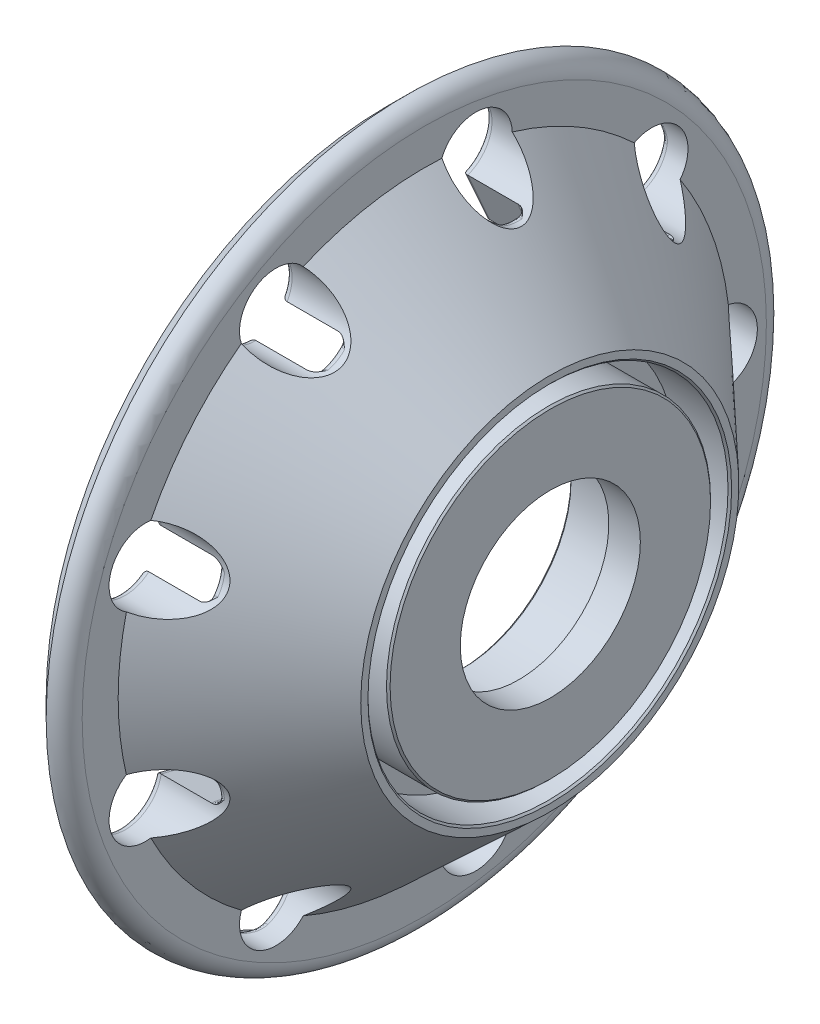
SolidWorks part; units mm, degrees
ref_plane "Plan de face" through (0, 0, 0) normal (0, 0, 1) x (1, 0, 0)
ref_plane "Plan de dessus" through (0, 0, 0) normal (0, 1, 0) x (1, 0, 0)
ref_plane "Plan de droite" through (0, 0, 0) normal (1, 0, 0) x (0, 0, -1)
ref_plane "Plan1" through (0, 0, 0) normal (0, 0, -1) x (-1, 0, 0)
sketch "Esquisse1" plane through (0, 0, 0) normal (0, 0, -1) x (-1, 0, 0)
  line L0 (0.0592, 21) -> (0.0592, 0)
  line L1 (0.0592, 0) -> (18, 0)
  line L2 (18, 0) -> (18, 38)
  line L3 (18, 38) -> (16, 40)
  line L4 (14, 38) -> (14, 34)
  line L5 (14, 34) -> (0.0592, 21)
  line L6 (0.0592, 0) -> (18, 0) construction
  arc A0 (16, 40) -> (14, 38) centre (16, 38) ccw
revolve "Révolution1" add sketch "Esquisse1" angle 360 about L6
sketch "Esquisse2" plane through (-18, 0, 0) normal (-1, 0, 0) x (0, 0, 1)
  line L0 (12.984, 26.489) -> (7.5426, 23.835)
  line L1 (7.5426, 23.835) -> (1.0643, 24.9773)
  line L2 (1.0643, 24.9773) -> (-3.1412, 29.3323)
  line L3 (-7.0805, 28.6377) -> (-9.5429, 23.107)
  line L4 (-9.5429, 23.107) -> (-15.2398, 19.8179)
  line L5 (-15.2398, 19.8179) -> (-21.2607, 20.4507)
  line L6 (-23.8319, 17.3865) -> (-22.1632, 11.567)
  line L7 (-22.1632, 11.567) -> (-24.4131, 5.3854)
  line L8 (-24.4131, 5.3854) -> (-29.4321, 2)
  line L9 (-29.4321, -2) -> (-24.4131, -5.3854)
  line L10 (-24.4131, -5.3854) -> (-22.1632, -11.567)
  line L11 (-22.1632, -11.567) -> (-23.8319, -17.3865)
  line L12 (-21.2607, -20.4507) -> (-15.2398, -19.8179)
  line L13 (-15.2398, -19.8179) -> (-9.5429, -23.107)
  line L14 (-9.5429, -23.107) -> (-7.0805, -28.6377)
  line L15 (-3.1412, -29.3323) -> (1.0643, -24.9773)
  line L16 (1.0643, -24.9773) -> (7.5426, -23.835)
  line L17 (7.5426, -23.835) -> (12.984, -26.489)
  line L18 (16.4481, -24.489) -> (16.8704, -18.4496)
  line L19 (16.8704, -18.4496) -> (21.0989, -13.4104)
  line L20 (21.0989, -13.4104) -> (26.9731, -11.9458)
  line L21 (28.3412, -8.187) -> (24.7827, -3.2891)
  line L22 (24.7827, -3.2891) -> (24.7827, 3.2891)
  line L23 (24.7827, 3.2891) -> (28.3412, 8.187)
  line L24 (26.9731, 11.9458) -> (21.0989, 13.4104)
  line L25 (21.0989, 13.4104) -> (16.8704, 18.4496)
  line L26 (16.8704, 18.4496) -> (16.4481, 24.489)
  arc A0 (-3.1412, 29.3323) -> (-7.0805, 28.6377) centre (-5.722, 32.4512) cw
  arc A1 (-21.2607, 20.4507) -> (-23.8319, 17.3865) centre (-25.2425, 21.181) cw
  arc A2 (-29.4321, 2) -> (-29.4321, -2) centre (-32.9518, 0) cw
  arc A3 (-23.8319, -17.3865) -> (-21.2607, -20.4507) centre (-25.2425, -21.181) cw
  arc A4 (-7.0805, -28.6377) -> (-3.1412, -29.3323) centre (-5.722, -32.4512) cw
  arc A5 (12.984, -26.489) -> (16.4481, -24.489) centre (16.4759, -28.5371) cw
  arc A6 (26.9731, -11.9458) -> (28.3412, -8.187) centre (30.9646, -11.2702) cw
  arc A7 (28.3412, 8.187) -> (26.9731, 11.9458) centre (30.9646, 11.2702) cw
  arc A8 (16.4481, 24.489) -> (12.984, 26.489) centre (16.4759, 28.5371) cw
extrude "Extrusion1" cut sketch "Esquisse2" against normal blind 8
draft "Dépouille1" [suppressed] type of draft neutral plane draft angle 2 faces to draft 9 parameters "D1"=2
ref_plane "Plan2" through (0, 28.5371, 0) normal (0, 1, 0) x (-1, 0, 0)
sketch "Esquisse3" plane through (0, 28.5371, 0) normal (0, 1, 0) x (-1, 0, 0)
  line L0 (8.5348, 16.4759) -> (8.5348, 12.4277)
  line L1 (8.5348, 12.4277) -> (14, 12.4277)
  line L2 (14, 12.4277) -> (14, 16.4759)
  line L3 (14, 16.4759) -> (8.5348, 16.4759)
  line L4 (14, 16.4759) -> (8.5348, 16.4759) construction
revolve "Révolution2" add sketch "Esquisse3" angle 360 about L3
ref_plane "Plan3" through (0, 0, 0) normal (0, 0.9397, 0.342) x (-1, 0, 0)
sketch "Esquisse4" plane through (0, 0, 0) normal (0, 0.9397, 0.342) x (-1, 0, 0)
  line L0 (8.5348, 37) -> (8.5348, 32.9518)
  line L1 (8.5348, 32.9518) -> (14, 32.9518)
  line L2 (14, 32.9518) -> (14, 37)
  line L3 (14, 37) -> (8.5348, 37)
  line L4 (8.5348, 32.9518) -> (14, 32.9518) construction
revolve "Révolution3" add sketch "Esquisse4" angle 360 about L1
ref_plane "Plan4" through (0, 0, 0) normal (0, 0.5, 0.866) x (1, 0, 0)
sketch "Esquisse5" plane through (0, 0, 0) normal (0, 0.5, 0.866) x (1, 0, 0)
  line L0 (-8.5348, -37) -> (-8.5348, -32.9518)
  line L1 (-8.5348, -32.9518) -> (-14, -32.9518)
  line L2 (-14, -32.9518) -> (-14, -37)
  line L3 (-14, -37) -> (-8.5348, -37)
  line L4 (-8.5348, -32.9518) -> (-14, -32.9518) construction
revolve "Révolution4" add sketch "Esquisse5" angle 360 about L4
ref_plane "Plan5" through (0, 0, 0) normal (0, -0.1736, 0.9848) x (1, 0, 0)
sketch "Esquisse6" plane through (0, 0, 0) normal (0, -0.1736, 0.9848) x (1, 0, 0)
  line L0 (-8.5348, -37) -> (-8.5348, -32.9518)
  line L1 (-8.5348, -32.9518) -> (-14, -32.9518)
  line L2 (-14, -32.9518) -> (-14, -37)
  line L3 (-14, -37) -> (-8.5348, -37)
  line L4 (-8.5348, -32.9518) -> (-14, -32.9518) construction
revolve "Révolution5" add sketch "Esquisse6" angle 360 about L1
ref_plane "Plan6" through (0, 0, 0) normal (0, 0.766, -0.6428) x (-1, 0, 0)
sketch "Esquisse7" plane through (0, 0, 0) normal (0, 0.766, -0.6428) x (-1, 0, 0)
  line L0 (8.5348, -28.9036) -> (8.5348, -32.9518)
  line L1 (8.5348, -32.9518) -> (14, -32.9518)
  line L2 (14, -32.9518) -> (14, -28.9036)
  line L3 (14, -28.9036) -> (8.5348, -28.9036)
  line L4 (8.5348, -32.9518) -> (14, -32.9518) construction
revolve "Révolution6" add sketch "Esquisse7" angle 360 about L1
sketch "Esquisse8" plane through (0, 0, 0) normal (0, 1, 0) x (1, 0, 0)
  line L0 (-8.5348, 32.9518) -> (-8.5348, 37)
  line L1 (-8.5348, 37) -> (-14, 37)
  line L2 (-14, 37) -> (-14, 32.9518)
  line L3 (-14, 32.9518) -> (-8.5348, 32.9518)
  line L4 (-14, 32.9518) -> (-8.5348, 32.9518) construction
revolve "Révolution7" add sketch "Esquisse8" angle 360 about L3
ref_plane "Plan7" through (0, 0, 0) normal (0, 0.766, 0.6428) x (-1, 0, 0)
sketch "Esquisse9" plane through (0, 0, 0) normal (0, 0.766, 0.6428) x (-1, 0, 0)
  line L0 (8.5348, -32.9518) -> (8.5348, -37)
  line L1 (8.5348, -37) -> (14, -37)
  line L2 (14, -37) -> (14, -32.9518)
  line L3 (14, -32.9518) -> (8.5348, -32.9518)
  line L4 (14, -32.9518) -> (8.5348, -32.9518) construction
revolve "Révolution8" add sketch "Esquisse9" angle 360 about L3
ref_plane "Plan8" through (0, 0, 0) normal (0, 0.1736, 0.9848) x (1, 0, 0)
sketch "Esquisse10" plane through (0, 0, 0) normal (0, 0.1736, 0.9848) x (1, 0, 0)
  line L0 (-8.5348, 28.9036) -> (-8.5348, 32.9518)
  line L1 (-8.5348, 32.9518) -> (-14, 32.9518)
  line L2 (-14, 32.9518) -> (-14, 28.9036)
  line L3 (-14, 28.9036) -> (-8.5348, 28.9036)
  line L4 (-8.5348, 32.9518) -> (-14, 32.9518) construction
revolve "Révolution9" add sketch "Esquisse10" angle 360 about L4
ref_plane "Plan9" through (0, 0, 0) normal (0, 0.9397, -0.342) x (-1, 0, 0)
sketch "Esquisse11" plane through (0, 0, 0) normal (0, 0.9397, -0.342) x (-1, 0, 0)
  line L0 (8.5348, 37) -> (8.5348, 32.9518)
  line L1 (8.5348, 32.9518) -> (14, 32.9518)
  line L2 (14, 32.9518) -> (14, 37)
  line L3 (14, 37) -> (8.5348, 37)
  line L4 (8.5348, 32.9518) -> (14, 32.9518) construction
revolve "Révolution10" add sketch "Esquisse11" angle 360 about L1
hole_wizard "Perçage1" positions "Esquisse13" profile "Esquisse12" legacy
sketch "Esquisse13" plane through (-0.0592, 0, 0) normal (1, 0, 0) x (0, 0, -1)
  point P0 (0, 0)
sketch "Esquisse12" plane through (-0.0592, 0, 0) normal (0, 1, 0) x (0, 0, -1)
  line L0 (0, 0) -> (0, 5.9408)
  line L1 (0, 5.9408) -> (20, 5.9408)
  line L2 (20, 5.9408) -> (20, 0)
  line L3 (20, 0) -> (0, 0)
  line L4 (0, 110) -> (0, -10) construction
  dimension "Diamètre" = 40
  dimension "Profondeur" = 5.9408
sketch "Esquisse14" plane through (0, 0, 0) normal (0, 1, 0) x (1, 0, 0)
  line L0 (-18, 37) -> (-18, 0)
  line L1 (-18, 0) -> (-17, 0)
  line L2 (-17, 0) -> (-17, 37)
  line L3 (-17, 37) -> (-18, 37)
  line L4 (-18, 0) -> (-17, 0) construction
revolve "Enlèvement de matière-Révolution1" cut sketch "Esquisse14" angle 360 about L1
ref_plane "Plan10" through (0, 0, 16.4759) normal (0, 0, 1) x (1, 0, 0)
sketch "Esquisse15" plane through (0, 0, 16.4759) normal (0, 0, 1) x (1, 0, 0)
  line L0 (-17, 32.5853) -> (-17, 28.5371)
  line L1 (-17, 28.5371) -> (-8.5348, 28.5371)
  line L2 (-8.5348, 28.5371) -> (-8.5348, 32.5853)
  line L3 (-8.5348, 32.5853) -> (-17, 32.5853)
  line L4 (-17, 28.5371) -> (-8.5348, 28.5371) construction
revolve "Enlèvement de matière-Révolution2" cut sketch "Esquisse15" angle 360 about L1
ref_plane "Plan11" through (0, 0, 30.9646) normal (0, 0, 1) x (1, 0, 0)
sketch "Esquisse16" plane through (0, 0, 30.9646) normal (0, 0, 1) x (1, 0, 0)
  line L0 (-17, 15.3184) -> (-17, 11.2702)
  line L1 (-17, 11.2702) -> (-8.5348, 11.2702)
  line L2 (-8.5348, 11.2702) -> (-8.5348, 15.3184)
  line L3 (-8.5348, 15.3184) -> (-17, 15.3184)
  line L4 (-17, 11.2702) -> (-8.5348, 11.2702) construction
revolve "Enlèvement de matière-Révolution3" cut sketch "Esquisse16" angle 360 about L1
ref_plane "Plan12" through (0, 0, 30.9646) normal (0, 0, 1) x (1, 0, 0)
sketch "Esquisse17" plane through (0, 0, 30.9646) normal (0, 0, 1) x (1, 0, 0)
  line L0 (-17, -7.222) -> (-17, -11.2702)
  line L1 (-17, -11.2702) -> (-8.5348, -11.2702)
  line L2 (-8.5348, -11.2702) -> (-8.5348, -7.222)
  line L3 (-8.5348, -7.222) -> (-17, -7.222)
  line L4 (-17, -11.2702) -> (-8.5348, -11.2702) construction
revolve "Enlèvement de matière-Révolution4" cut sketch "Esquisse17" angle 360 about L1
ref_plane "Plan13" through (0, 0, 16.4759) normal (0, 0, 1) x (1, 0, 0)
sketch "Esquisse18" plane through (0, 0, 16.4759) normal (0, 0, 1) x (1, 0, 0)
  line L0 (-17, -24.4889) -> (-17, -28.5371)
  line L1 (-17, -28.5371) -> (-8.5348, -28.5371)
  line L2 (-8.5348, -28.5371) -> (-8.5348, -24.4889)
  line L3 (-8.5348, -24.4889) -> (-17, -24.4889)
  line L4 (-17, -28.5371) -> (-8.5348, -28.5371) construction
revolve "Enlèvement de matière-Révolution5" cut sketch "Esquisse18" angle 360 about L1
ref_plane "Plan14" through (0, 0, -5.722) normal (0, 0, 1) x (1, 0, 0)
sketch "Esquisse19" plane through (0, 0, -5.722) normal (0, 0, 1) x (1, 0, 0)
  line L0 (-17, -28.403) -> (-17, -32.4512)
  line L1 (-17, -32.4512) -> (-8.5348, -32.4512)
  line L2 (-8.5348, -32.4512) -> (-8.5348, -28.403)
  line L3 (-8.5348, -28.403) -> (-17, -28.403)
  line L4 (-17, -32.4512) -> (-8.5348, -32.4512) construction
revolve "Enlèvement de matière-Révolution6" cut sketch "Esquisse19" angle 360 about L1
ref_plane "Plan15" through (0, 0, -25.2425) normal (0, 0, 1) x (1, 0, 0)
sketch "Esquisse20" plane through (0, 0, -25.2425) normal (0, 0, 1) x (1, 0, 0)
  line L0 (-17, -17.1328) -> (-17, -21.181)
  line L1 (-17, -21.181) -> (-8.5348, -21.181)
  line L2 (-8.5348, -21.181) -> (-8.5348, -17.1328)
  line L3 (-8.5348, -17.1328) -> (-17, -17.1328)
  line L4 (-17, -21.181) -> (-8.5348, -21.181) construction
revolve "Enlèvement de matière-Révolution7" cut sketch "Esquisse20" angle 360 about L1
ref_plane "Plan16" through (0, 0, -32.9518) normal (0, 0, 1) x (1, 0, 0)
sketch "Esquisse21" plane through (0, 0, -32.9518) normal (0, 0, 1) x (1, 0, 0)
  line L0 (-17, 4.0482) -> (-17, 0)
  line L1 (-17, 0) -> (-8.5348, 0)
  line L2 (-8.5348, 0) -> (-8.5348, 4.0482)
  line L3 (-8.5348, 4.0482) -> (-17, 4.0482)
  line L4 (-17, 0) -> (-8.5348, 0) construction
revolve "Enlèvement de matière-Révolution8" cut sketch "Esquisse21" angle 360 about L1
ref_plane "Plan17" through (0, 0, -25.2425) normal (0, 0, 1) x (1, 0, 0)
sketch "Esquisse22" plane through (0, 0, -25.2425) normal (0, 0, 1) x (1, 0, 0)
  line L0 (-17, 25.2292) -> (-17, 21.181)
  line L1 (-17, 21.181) -> (-8.5348, 21.181)
  line L2 (-8.5348, 21.181) -> (-8.5348, 25.2292)
  line L3 (-8.5348, 25.2292) -> (-17, 25.2292)
  line L4 (-17, 21.181) -> (-8.5348, 21.181) construction
revolve "Enlèvement de matière-Révolution9" cut sketch "Esquisse22" angle 360 about L1
ref_plane "Plan18" through (0, 0, -5.722) normal (0, 0, 1) x (1, 0, 0)
sketch "Esquisse23" plane through (0, 0, -5.722) normal (0, 0, 1) x (1, 0, 0)
  line L0 (-17, 36.4994) -> (-17, 32.4512)
  line L1 (-17, 32.4512) -> (-8.5348, 32.4512)
  line L2 (-8.5348, 32.4512) -> (-8.5348, 36.4994)
  line L3 (-8.5348, 36.4994) -> (-17, 36.4994)
  line L4 (-17, 32.4512) -> (-8.5348, 32.4512) construction
revolve "Enlèvement de matière-Révolution10" cut sketch "Esquisse23" angle 360 about L1
sketch "Esquisse24" plane through (0, 0, 0) normal (0, 0, -1) x (-1, 0, 0)
  line L0 (0, 18) -> (0, 0)
  line L1 (0, 0) -> (6, 0)
  line L2 (6, 0) -> (6, 18)
  line L3 (6, 18) -> (0, 18)
  line L4 (0, 0) -> (6, 0) construction
revolve "Révolution11" add sketch "Esquisse24" angle 360 about L1
fillet "Congé7" radius 0.75 9 edges at (-10, 25.0312, 14.4518) (-10, 0, -28.9036) (-10, -18.5789, -22.1414) (-10, -28.4645, -5.0191) (-10, -25.0312, 14.4518) (-10, -9.8856, 27.1605) (-10, 9.8856, 27.1605) (-10, 18.5789, -22.1414) (-10, 28.4645, -5.0191)
fillet "Congé8" radius 0.75 45 edges at (-9.835, 26.3656, 12.7311) (-9.7175, 24.3253, 16.4596) (-10, 15.93, 18.9846) (-10, 12.769, 23.6712) (-10, 5.4339, 26.341) (-10, 0, 24.7827) (-10, -5.4339, 26.341) (-10, -12.769, 23.6712) (-10, -15.93, 18.9846) (-10, -21.0943, 16.6855) (-10, -24.9972, 9.9254) (-10, -24.4062, 4.3035) (-10, -26.8844, -0.7773) (-10, -25.5289, -8.4646) (-10, -21.4624, -12.3913) (-10, -20.095, -17.8764) (-10, -14.1154, -22.8939) (-10, -8.4762, -23.2881) (-10, -3.9029, -26.6109) (-10, 3.9029, -26.6109) (-10, 8.4762, -23.2881) (-10, 14.1154, -22.8939) (-10, 20.095, -17.8764) (-10, 21.4624, -12.3913) (-10, 25.5289, -8.4646) (-10, 26.8844, -0.7773) (-10, 24.4062, 4.3035) (-10, 24.9972, 9.9254) (-10, 21.0943, 16.6855) (-9.835, 17.116, -23.7543) (-9.7175, 20.4335, -21.0976) (-9.835, 28.3806, -7.1949) (-9.7175, 29.2143, -3.0273) (-9.835, 12.0138, 26.7001) (-9.7175, 8.0543, 28.2448) (-9.835, -7.9593, 28.1758) (-9.7175, -11.9854, 26.814) (-9.835, -24.2082, 16.4677) (-9.7175, -26.4171, 12.8366) (-9.835, -29.1299, -2.9457) (-9.7175, -28.4878, -7.1472) (-9.835, -20.4213, -20.9809) (-9.7175, -17.2288, -23.7867) (-9.835, -2.1574, -29.1988) (-9.7175, 2.0917, -29.2961)
hole_wizard "Perçage2" positions "Esquisse26" profile "Esquisse25" legacy
sketch "Esquisse26" plane through (-10, 0, 0) normal (-1, 0, 0) x (0, 0, 1)
  point P0 (0, 0)
sketch "Esquisse25" plane through (-10, 0, 0) normal (0, 1, 0) x (0, 0, 1)
  line L0 (0, 0) -> (0, 10)
  line L1 (0, 10) -> (10, 10)
  line L2 (10, 10) -> (10, 6.5)
  line L3 (10, 6.5) -> (12, 6.5)
  line L4 (12, 6.5) -> (12, 0)
  line L5 (12, 0) -> (0, 0)
  line L6 (0, 110) -> (0, -10) construction
  dimension "Diamètre" = 20
  dimension "Profondeur" = 10
  dimension "Diamètre chambrage" = 24
  dimension "Profondeur chambrage" = 6.5
chamfer "Chanfrein1" distance 0.2 angle 45 1 edges at (0, 0, 18)
chamfer "Chanfrein2" distance 0.2 angle 45 1 edges at (-0.0592, 0, -20)
hole_wizard "Trou taraudé M25" positions "Esquisse3D3" profile "Esquisse35" tap size "M2" standard "ISO"
sketch3d "Esquisse3D3"
  line L0 (6.631, 0, 0) -> (-61.2619, 0, 0) construction
  point P0 (-10, 0, -16)
  dimension "D1" = 16
sketch "Esquisse35" plane through (-10, 0, -16) normal (0, 1, 0) x (0, 0, 1)
  line L0 (0, 0) -> (0, 8.4807)
  line L1 (0, 8.4807) -> (0.8, 8)
  line L2 (0.8, 8) -> (0.8, 0)
  line L5 (0.8, 0) -> (0, 0)
  line L10 (0, 8.4807) -> (-0.8, 8) construction
  line L11 (0, -6.35) -> (0, 107.95) construction
  dimension "Diamètre du trou pour taraudage" = 1.6
  dimension "Profondeur du trou pour taraudage" = 8
  dimension "Angle de pointe" = 118
hole_wizard "Trou taraudé M22" positions "Esquisse28" profile "Esquisse27" tap size "M2" standard "ISO"
sketch "Esquisse28" plane through (-10, 0, 0) normal (-1, 0, 0) x (0, 0, 1)
  point P0 (8, -13.8564)
sketch "Esquisse27" plane through (-10, -13.8564, 8) normal (0, 1, 0) x (0, 0, 1)
  line L0 (0, 0) -> (0, 8.4807)
  line L1 (0, 8.4807) -> (0.8, 8)
  line L2 (0.8, 8) -> (0.8, 0)
  line L5 (0.8, 0) -> (0, 0)
  line L10 (0, 8.4807) -> (-0.8, 8) construction
  line L11 (0, -6.35) -> (0, 107.95) construction
  dimension "Diamètre du trou pour taraudage" = 1.6
  dimension "Profondeur du trou pour taraudage" = 8
  dimension "Angle de pointe" = 118
hole_wizard "Trou taraudé M26" positions "Esquisse30" profile "Esquisse29" tap size "M2" standard "ISO"
sketch "Esquisse30" plane through (-10, 0, 0) normal (-1, 0, 0) x (0, 0, 1)
  point P0 (8, 13.8564)
sketch "Esquisse29" plane through (-10, 13.8564, 8) normal (0, 1, 0) x (0, 0, 1)
  line L0 (0, 0) -> (0, 8.4807)
  line L1 (0, 8.4807) -> (0.8, 8)
  line L2 (0.8, 8) -> (0.8, 0)
  line L5 (0.8, 0) -> (0, 0)
  line L10 (0, 8.4807) -> (-0.8, 8) construction
  line L11 (0, -6.35) -> (0, 107.95) construction
  dimension "Diamètre du trou pour taraudage" = 1.6
  dimension "Profondeur du trou pour taraudage" = 8
  dimension "Angle de pointe" = 118
chamfer "Chanfrein3" distance 0.3 angle 45 1 edges at (-10, 0, 12)
fillet "Congé1" radius 0.2 1 edges at (-3.5, 0, 12)
fillet "Congé9" radius 0.75 9 edges at (-17, 23.7831, 28.3436) (-17, 0, 37) (-17, -23.7831, 28.3436) (-17, -36.4379, 6.425) (-17, -32.0429, -18.5) (-17, -12.6547, -34.7686) (-17, 12.6547, -34.7686) (-17, 32.0429, -18.5) (-17, 36.4379, 6.425)
fillet "Congé12" radius 0.75 63 edges at (-17.0931, -22.1085, -29.1831) (-17.0931, -24.9006, -26.8402) (-17, -17.9096, -27.627) (-17, -24.0973, -22.4349) (-17.0931, 1.8224, -36.5666) (-17.0931, 22.1085, -29.1831) (-17.0931, 24.9006, -26.8402) (-17.0931, 35.6946, -8.1444) (-17.0931, 36.3275, -4.555) (-17.0931, 32.5788, 16.7051) (-17.0931, 30.7564, 19.8615) (-17.0931, 14.219, 33.7381) (-17.0931, 10.794, 34.9847) (-17.0931, -10.794, 34.9847) (-17.0931, -14.219, 33.7381) (-17.0931, -30.7564, 19.8615) (-17.0931, -32.5788, 16.7051) (-17.0931, -36.3275, -4.555) (-17.0931, -1.8224, -36.5666) (-17.0931, -35.6946, -8.1444) (-17, 14.4767, -22.9975) (-17, 8.4762, -23.2881) (-17, 3.6927, -26.9226) (-17, 4.0388, -32.6756) (-17, 17.9096, -27.627) (-17, 25.8723, -8.3117) (-17, 21.4624, -12.3913) (-17, 20.1343, -18.2503) (-17, 24.0973, -22.4349) (-17, 31.4778, -9.6515) (-17, 25.162, 10.2633) (-17, 24.4062, 4.3035) (-17, 27.1548, -1.0385) (-17, 32.8805, -1.6966) (-17, 30.3173, 12.8401) (-17, 12.6781, 24.036) (-17, 15.93, 18.9846) (-17, 21.4693, 16.6593) (-17, 26.2785, 19.8355) (-17, 14.9709, 29.3237) (-17, -5.7381, 26.5619) (-17, 0, 24.7827) (-17, 5.7381, 26.5619) (-17, 7.3805, 32.0863) (-17, -7.3805, 32.0863) (-17, -21.4693, 16.6593) (-17, -15.93, 18.9846) (-17, -12.6781, 24.036) (-17, -14.9709, 29.3237) (-17, -26.2785, 19.8355) (-17, -27.1548, -1.0385) (-17, -24.4062, 4.3035) (-17, -25.162, 10.2633) (-17, -30.3173, 12.8401) (-17, -32.8805, -1.6966) (-17, -3.6927, -26.9226) (-17, -8.4762, -23.2881) (-17, -14.4767, -22.9975) (-17, -4.0388, -32.6756) (-17, -20.1343, -18.2503) (-17, -21.4624, -12.3913) (-17, -25.8723, -8.3117) (-17, -31.4778, -9.6515)
